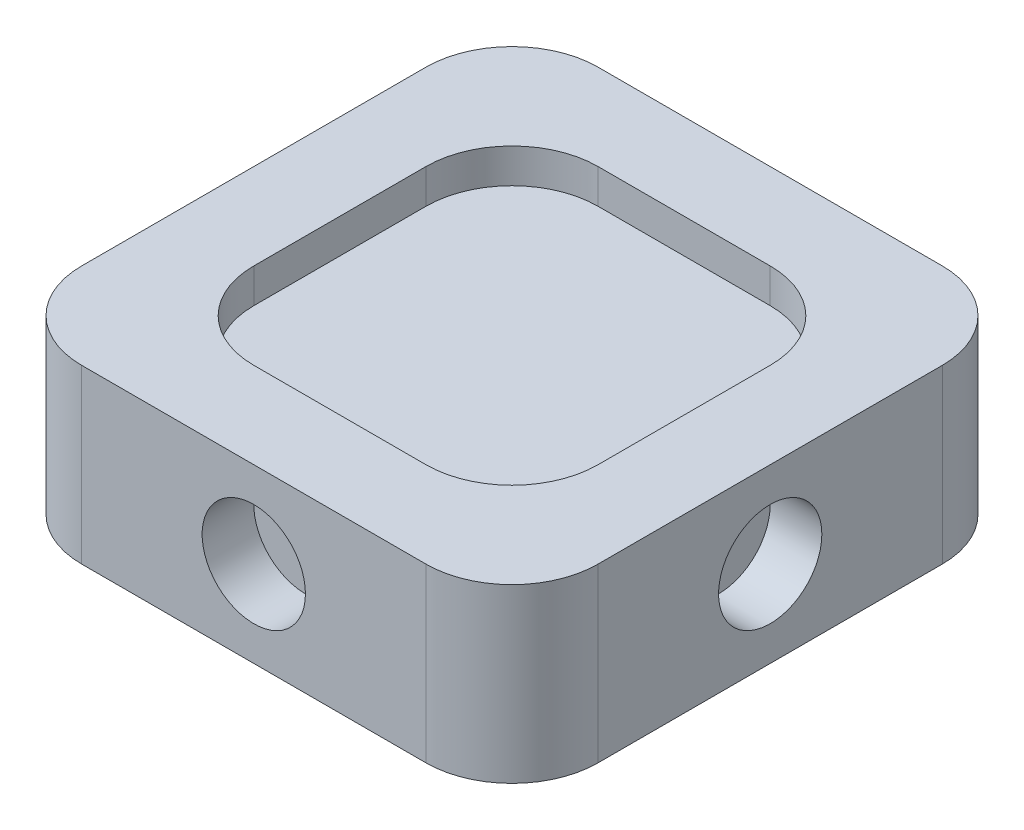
SolidWorks part; units mm, degrees
ref_plane "Front Plane" through (0, 0, 0) normal (0, 0, 1) x (1, 0, 0)
ref_plane "Top Plane" through (0, 0, 0) normal (0, 1, 0) x (1, 0, 0)
ref_plane "Right Plane" through (0, 0, 0) normal (1, 0, 0) x (0, 0, -1)
sketch "Sketch2" plane through (0, 0, 0) normal (0, 1, 0) x (1, 0, 0)
  line L1 (-15, 15) -> (15, 15)
  line L2 (-15, 15) -> (-15, -15)
  line L3 (-15, -15) -> (15, -15)
  line L4 (15, 15) -> (15, -15)
  line L5 (-15, 15) -> (15, -15) construction
  line L6 (-15, -15) -> (15, 15) construction
  point P0 (0, 0)
  dimension "D1" = 30
  dimension "D2" = 30
extrude "Boss-Extrude1" add sketch "Sketch2" along normal blind 10
sketch "Sketch3" plane through (0, 0, 15) normal (0, 0, 1) x (1, 0, 0)
  line L0 (-15, 10) -> (15, 10) construction
  circle A0 centre (0, 5) radius 3
  dimension "D1" = 6
  dimension "D2" = 5
extrude "Cut-Extrude1" cut sketch "Sketch3" against normal blind 3
sketch "Sketch4" plane through (15, 0, 0) normal (1, 0, 0) x (0, 0, -1)
  line L0 (-15, 10) -> (15, 10) construction
  circle A0 centre (0, 5) radius 3
  dimension "D2" = 6
  dimension "D1" = 5
extrude "Cut-Extrude2" cut sketch "Sketch4" against normal blind 3
sketch "Sketch5" plane through (0, 0, -15) normal (0, 0, -1) x (-1, 0, 0)
  line L0 (-15, 10) -> (15, 10) construction
  circle A0 centre (0, 5) radius 3
  dimension "D1" = 6
  dimension "D2" = 5
extrude "Cut-Extrude3" cut sketch "Sketch5" against normal blind 3
sketch "Sketch6" plane through (-15, 0, 0) normal (-1, 0, 0) x (0, 0, 1)
  line L0 (-15, 10) -> (15, 10) construction
  circle A0 centre (0, 5) radius 3
  dimension "D1" = 6
  dimension "D2" = 5
extrude "Cut-Extrude4" cut sketch "Sketch6" against normal blind 3
fillet "Fillet1" radius 5 4 edges at (-15, 5, -15) (15, 5, -15) (15, 5, 15) (-15, 5, 15)
sketch "Sketch8" plane through (0, 10, 0) normal (0, 1, 0) x (1, 0, 0)
  line L8 (10, 10) -> (-10, 10)
  line L9 (-10, 10) -> (-10, -10)
  line L10 (-10, -10) -> (10, -10)
  line L11 (10, -10) -> (10, 10)
  line L12 (10, 10) -> (-10, 10)
  line L13 (-10, 10) -> (-10, -10)
  line L14 (-10, -10) -> (10, -10)
  line L15 (10, -10) -> (10, 10)
  dimension "D1" = 5
extrude "Cut-Extrude6" cut sketch "Sketch8" against normal blind 2
fillet "Fillet2" radius 5 4 edges at (10, 9, 10) (10, 9, -10) (-10, 9, 10) (-10, 9, -10)
sketch "Sketch9" plane through (0, 0, 0) normal (0, -1, 0) x (-1, 0, 0)
  line L1 (10, -10) -> (-10, -10)
  line L2 (10, -10) -> (10, 10)
  line L3 (10, 10) -> (-10, 10)
  line L4 (-10, -10) -> (-10, 10)
  line L5 (10, -10) -> (-10, 10) construction
  line L6 (10, 10) -> (-10, -10) construction
  point P0 (0, 0)
  dimension "D1" = 20
  dimension "D2" = 20
extrude "Cut-Extrude7" cut sketch "Sketch9" against normal blind 2
fillet "Fillet3" radius 5 4 edges at (10, 1, -10) (-10, 1, -10) (10, 1, 10) (-10, 1, 10)
